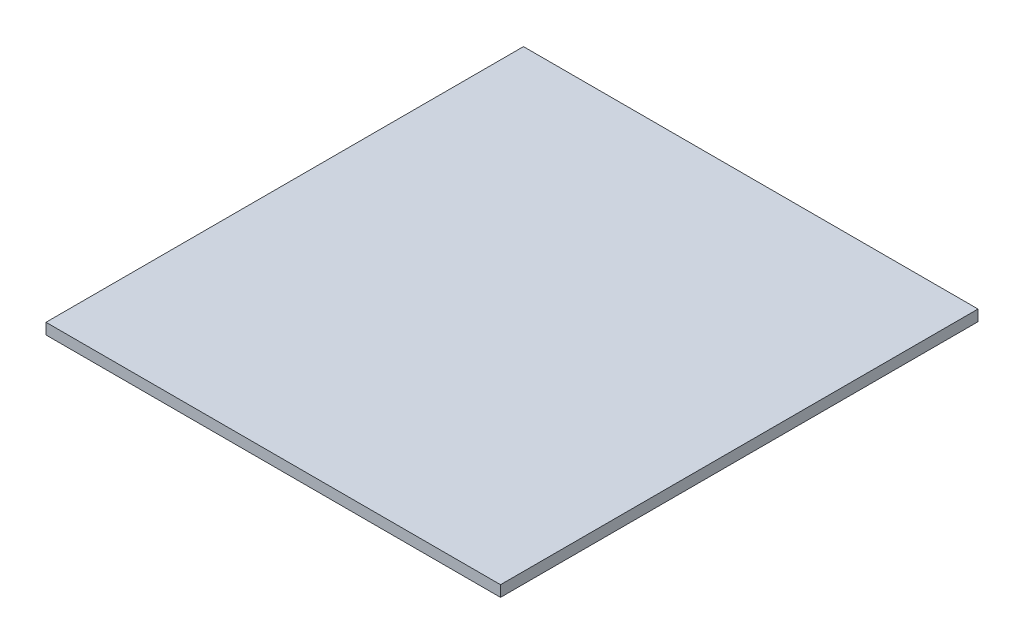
SolidWorks part; units mm, degrees
ref_plane "Front Plane" through (0, 0, 0) normal (0, 0, 1) x (1, 0, 0)
ref_plane "Top Plane" through (0, 0, 0) normal (0, 1, 0) x (1, 0, 0)
ref_plane "Right Plane" through (0, 0, 0) normal (1, 0, 0) x (0, 0, -1)
sketch "Sketch1" plane through (0, 0, 0) normal (0, 1, 0) x (1, 0, 0)
  line L1 (-247.5, -260) -> (247.5, -260)
  line L2 (-247.5, -260) -> (-247.5, 260)
  line L3 (-247.5, 260) -> (247.5, 260)
  line L4 (247.5, -260) -> (247.5, 260)
  line L5 (-247.5, -260) -> (247.5, 260) construction
  line L6 (-247.5, 260) -> (247.5, -260) construction
  point P0 (0, 0)
  dimension "D1" = 520
  dimension "D2" = 495
extrude "Boss-Extrude1" add sketch "Sketch1" along normal blind 12
